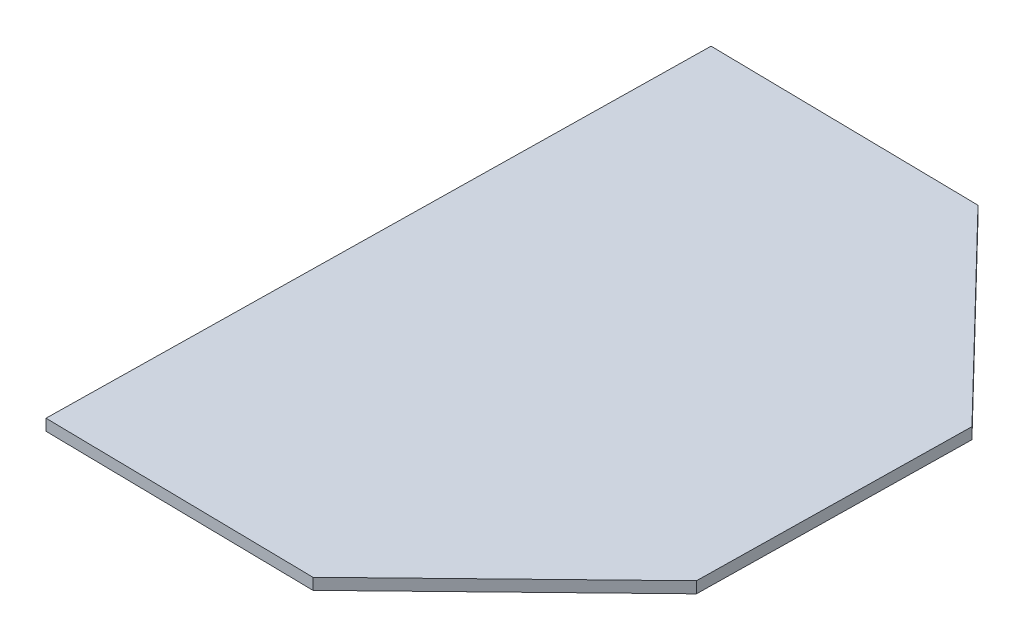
SolidWorks part; units mm, degrees
ref_plane "Front" through (0, 0, 0) normal (0, 0, 1) x (1, 0, 0)
ref_plane "Top" through (0, 0, 0) normal (0, 1, 0) x (1, 0, 0)
ref_plane "Right" through (0, 0, 0) normal (1, 0, 0) x (0, 0, -1)
sketch "Sketch1" plane through (0, 0, 0) normal (0, 1, 0) x (1, 0, 0)
  line L0 (-138.0182, 348.6775) -> (-148.9586, -344.1458)
  line L1 (148.9586, 344.1458) -> (-138.0182, 348.6775)
  line L5 (-148.9586, -344.1458) -> (138.0182, -348.6775)
  line L6 (138.0182, -348.6775) -> (344.1458, -148.9586)
  line L7 (344.1458, -148.9586) -> (348.6775, 138.0182)
  line L8 (348.6775, 138.0182) -> (148.9586, 344.1458)
  line L10 (-138.0182, 348.6775) -> (-241.082, 248.8181)
  line L11 (-346.4116, 5.4702) -> (-348.6775, -138.0182)
  line L12 (-248.8181, -241.082) -> (-148.9586, -344.1458)
  dimension "D1" = 750
extrude "Boss-Extrude1" add sketch "Sketch1" along normal blind 12
